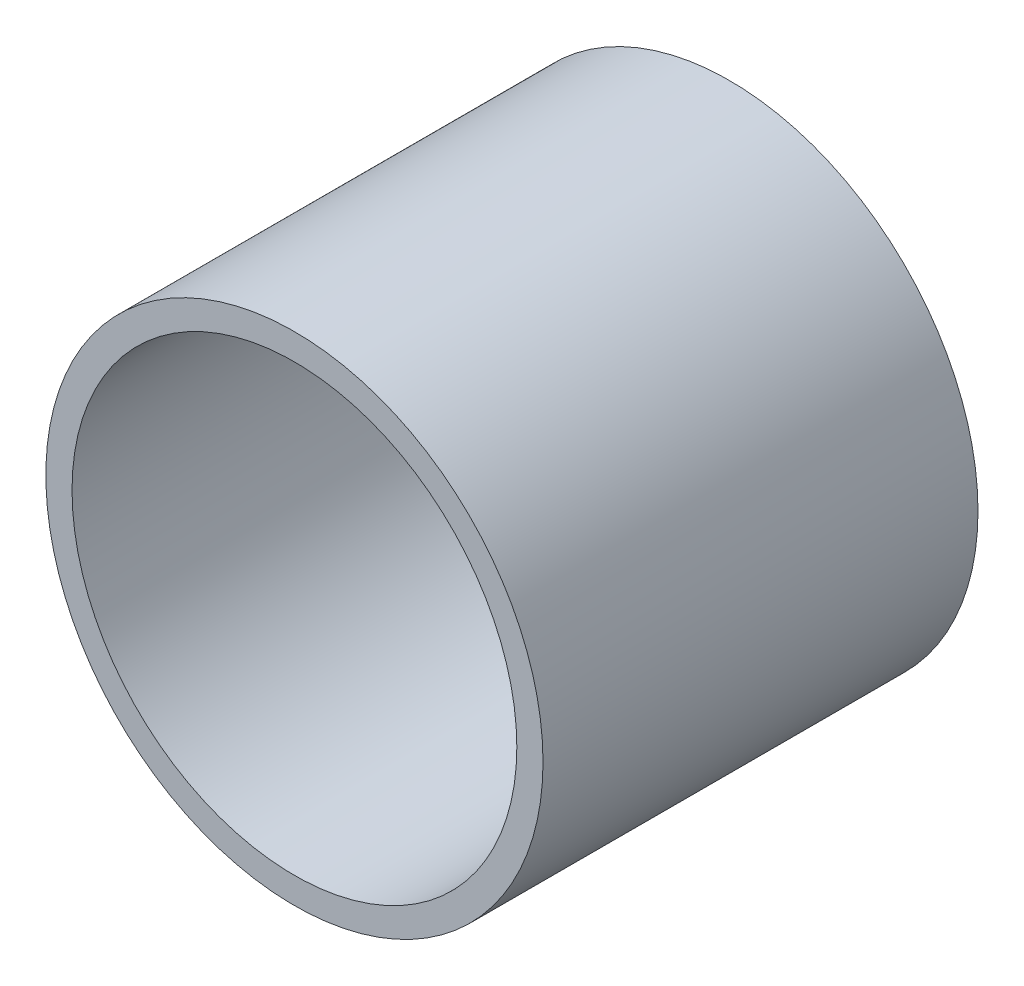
SolidWorks part; units mm, degrees
ref_plane "Front" through (0, 0, 0) normal (0, 0, 1) x (1, 0, 0)
ref_plane "Top" through (0, 0, 0) normal (0, 1, 0) x (1, 0, 0)
ref_plane "Side" through (0, 0, 0) normal (1, 0, 0) x (0, 0, -1)
sketch "PipeSketch" plane through (0, 0, 0) normal (0, 0, 1) x (1, 0, 0)
  circle A0 centre (0, 0) radius 57.15
  circle A1 centre (0, 0) radius 51.1302
  dimension "OuterDiameter" = 114.3
  dimension "InnerDiameter" = 102.2604
extrude "Extrusion" add sketch "PipeSketch" along normal blind 100
sketch "FilterSketch" plane through (0, 0, 0) normal (0, 0, 1) x (1, 0, 0)
  circle A0 centre (0, 0) radius 50.8 construction
  dimension "NominalDiameter" = 101.6
